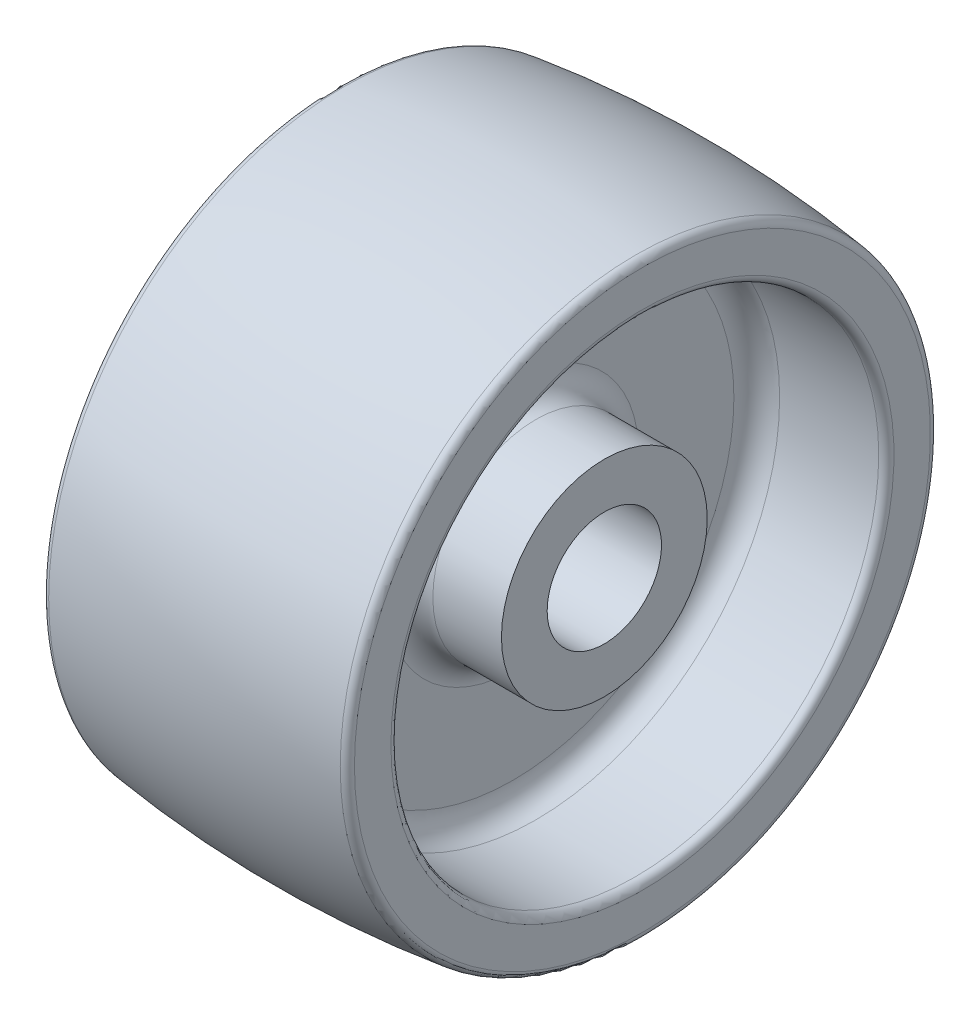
SolidWorks part; units mm, degrees
ref_plane "Face" through (0, 0, 0) normal (0, 0, 1) x (1, 0, 0)
ref_plane "Dessus" through (0, 0, 0) normal (0, 1, 0) x (1, 0, 0)
ref_plane "Droite" through (0, 0, 0) normal (1, 0, 0) x (0, 0, -1)
sketch "Esquisse1" plane through (0, 0, 0) normal (0, 0, 1) x (1, 0, 0)
  line L0 (40, 64) -> (6, 64)
  line L1 (0, 92.8519) -> (0, 80) construction
  line L2 (0, 15) -> (0, -10.6621) construction
  line L3 (-30, 27) -> (-30, 15)
  line L4 (40, 64) -> (40, 77.3214)
  line L5 (6, 27) -> (30, 27)
  line L6 (6, 64) -> (6, 27)
  line L7 (30, 27) -> (30, 15)
  line L8 (-30, 15) -> (30, 15)
  line L9 (-6, 64) -> (-6, 27)
  line L10 (-6, 27) -> (-30, 27)
  line L11 (-40, 64) -> (-40, 77.3214)
  line L12 (-40, 64) -> (-6, 64)
  line L13 (-44.4786, 0) -> (44.5035, 0) construction
  arc A0 (40, 77.3214) -> (-40, 77.3214) centre (0, -220) ccw
  dimension "D7" = 600
  dimension "D1" = 6
  dimension "D2" = 15
  dimension "D5" = 34
  dimension "D6" = 24
revolve "Révolution1" add sketch "Esquisse1" angle 360 about L13
fillet "Congé1" radius 6
fillet "Congé2" radius 2
